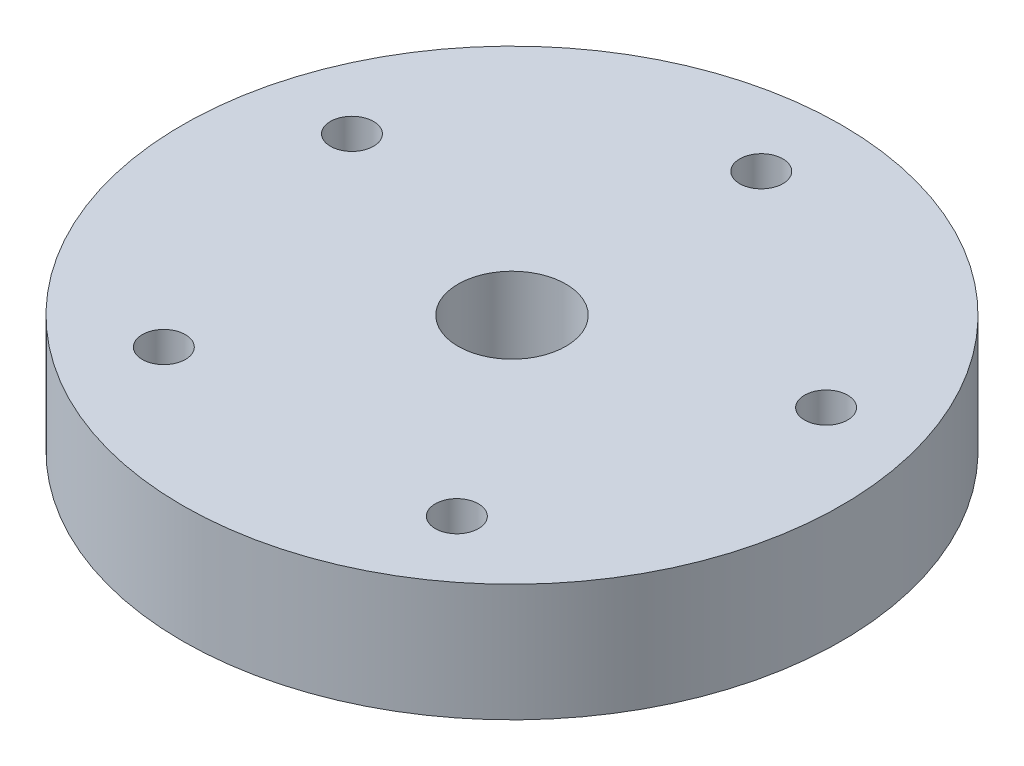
SolidWorks part; units mm, degrees
ref_plane "Front Plane" through (0, 0, 0) normal (0, 0, 1) x (1, 0, 0)
ref_plane "Top Plane" through (0, 0, 0) normal (0, 1, 0) x (1, 0, 0)
ref_plane "Right Plane" through (0, 0, 0) normal (1, 0, 0) x (0, 0, -1)
sketch "Sketch1" plane through (0, 0, 0) normal (0, 1, 0) x (1, 0, 0)
  circle A0 centre (0, 0) radius 17.4625
  circle A1 centre (0, 0) radius 2.8575
  circle A2 centre (0, 13.208) radius 1.143
  circle A3 centre (12.5616, 4.0815) radius 1.143
  circle A4 centre (7.7635, -10.6855) radius 1.143
  circle A5 centre (-7.7635, -10.6855) radius 1.143
  circle A6 centre (-12.5616, 4.0815) radius 1.143
  point P16 (0, 0)
  dimension "D1" = 34.925
  dimension "D2" = 5.715
  dimension "D3" = 2.286
  dimension "D4" = 13.208
  dimension "D5" = 5
extrude "Boss-Extrude1" add sketch "Sketch1" along normal blind 6.223
